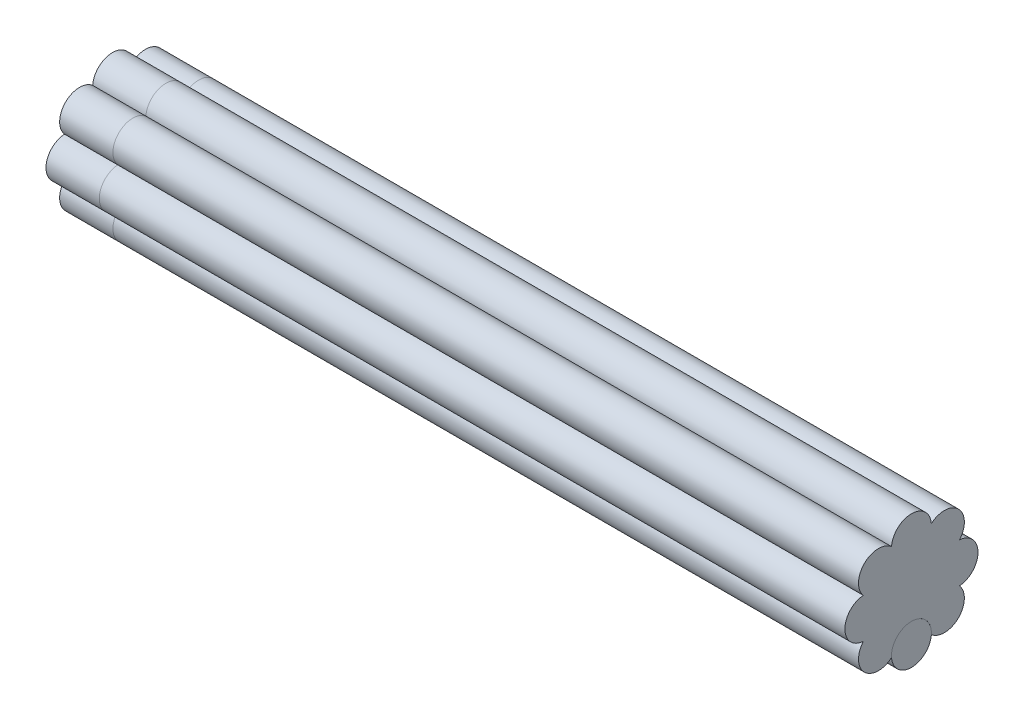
SolidWorks part; units mm, degrees
ref_plane "Alzado" through (0, 0, 0) normal (0, 0, 1) x (1, 0, 0)
ref_plane "Planta" through (0, 0, 0) normal (0, 1, 0) x (1, 0, 0)
ref_plane "Vista lateral" through (0, 0, 0) normal (1, 0, 0) x (0, 0, -1)
sketch "Croquis2" plane through (0, 0, 0) normal (1, 0, 0) x (0, 0, -1)
  circle A0 centre (0, 0) radius 17.5 construction
  circle A1 centre (0, 0) radius 25 construction
  circle A3 centre (0, 0) radius 17.5 construction
  circle A5 centre (0, 0) radius 17.5 construction
  circle A7 centre (0, 0) radius 17.5 construction
  circle A9 centre (0, 0) radius 17.5 construction
  circle A11 centre (0, 0) radius 17.5 construction
  circle A13 centre (0, 0) radius 17.5 construction
  circle A15 centre (0, 0) radius 17.5 construction
  circle A17 centre (0, 0) radius 17.5 construction
  circle A19 centre (0, 0) radius 17.5 construction
  circle A21 centre (0, 0) radius 17.5 construction
  circle A23 centre (0, 0) radius 17.5 construction
  circle A25 centre (0, 0) radius 17.5 construction
  arc A28 (7.4793, 18.0567) -> (-7.4793, 18.0567) centre (0, 17.5) ccw
  arc A31 (7.4793, -18.0567) -> (-7.4793, -18.0567) centre (0, -17.5) ccw
  arc A45 (18.0567, 7.4793) -> (7.4793, 18.0567) centre (12.3744, 12.3744) ccw
  arc A46 (18.0567, -7.4793) -> (18.0567, 7.4793) centre (17.5, 0) ccw
  arc A47 (7.4793, -18.0567) -> (18.0567, -7.4793) centre (12.3744, -12.3744) ccw
  arc A49 (-18.0567, -7.4793) -> (-7.4793, -18.0567) centre (-12.3744, -12.3744) ccw
  arc A51 (-7.4793, 18.0567) -> (-18.0567, 7.4793) centre (-12.3744, 12.3744) ccw
  arc A52 (-18.0567, 7.4793) -> (-18.0567, -7.4793) centre (-17.5, 0) ccw
  point P29 (0, 0)
  point P45 (0, 0)
  dimension "D1" = 35
  dimension "D2" = 50
  dimension "D3" = 13
extrude "Saliente-Extruir1" add sketch "Croquis2" against normal blind 280
sketch "Croquis3" plane through (0, 0, 0) normal (1, 0, 0) x (0, 0, -1)
  circle A0 centre (0, -17.5) radius 7.5
  arc A1 (7.4793, -18.0567) -> (-7.4793, -18.0567) centre (0, -17.5) ccw construction
  point P3 (0, 0)
  dimension "D1" = 15
extrude "Saliente-Extruir2" add sketch "Croquis3" against normal blind 280 separate body
sketch "Croquis4" plane through (-280, 0, 0) normal (-1, 0, 0) x (0, 0, 1)
  circle A0 centre (0, -17.5) radius 7.5 construction
  arc A1 (-7.4793, -18.0567) -> (7.4793, -18.0567) centre (0, -17.5) ccw
  arc A10 (-7.4793, 18.0567) -> (-18.0567, 7.4793) centre (-12.3744, 12.3744) ccw
  arc A11 (-7.4793, 18.0567) -> (-18.0567, 7.4793) centre (-12.3744, 12.3744) ccw
  arc A12 (-18.0567, 7.4793) -> (-18.0567, -7.4793) centre (-17.5, 0) ccw
  arc A13 (-18.0567, 7.4793) -> (-18.0567, -7.4793) centre (-17.5, 0) ccw
  arc A14 (-18.0567, -7.4793) -> (-7.4793, -18.0567) centre (-12.3744, -12.3744) ccw
  arc A15 (-18.0567, -7.4793) -> (-7.4793, -18.0567) centre (-12.3744, -12.3744) ccw
  arc A16 (7.4793, 18.0567) -> (-7.4793, 18.0567) centre (0, 17.5) ccw
  arc A18 (7.4793, -18.0567) -> (18.0567, -7.4793) centre (12.3744, -12.3744) ccw
  arc A19 (7.4793, -18.0567) -> (18.0567, -7.4793) centre (12.3744, -12.3744) ccw
  arc A20 (18.0567, -7.4793) -> (18.0567, 7.4793) centre (17.5, 0) ccw
  arc A21 (18.0567, -7.4793) -> (18.0567, 7.4793) centre (17.5, 0) ccw
  arc A22 (18.0567, 7.4793) -> (7.4793, 18.0567) centre (12.3744, 12.3744) ccw
  arc A23 (18.0567, 7.4793) -> (7.4793, 18.0567) centre (12.3744, 12.3744) ccw
  arc A24 (7.4793, 18.0567) -> (-7.4793, 18.0567) centre (0, 17.5) ccw
  arc A38 (7.4793, -18.0567) -> (-7.4793, -18.0567) centre (0, -17.5) ccw
  dimension "D1" = 0
extrude "Saliente-Extruir3" add sketch "Croquis4" along normal blind 20 separate body
sketch "Croquis5" plane through (0, 0, 0) normal (1, 0, 0) x (0, 0, -1)
  circle A0 centre (0, 0) radius 15
  dimension "D1" = 30
